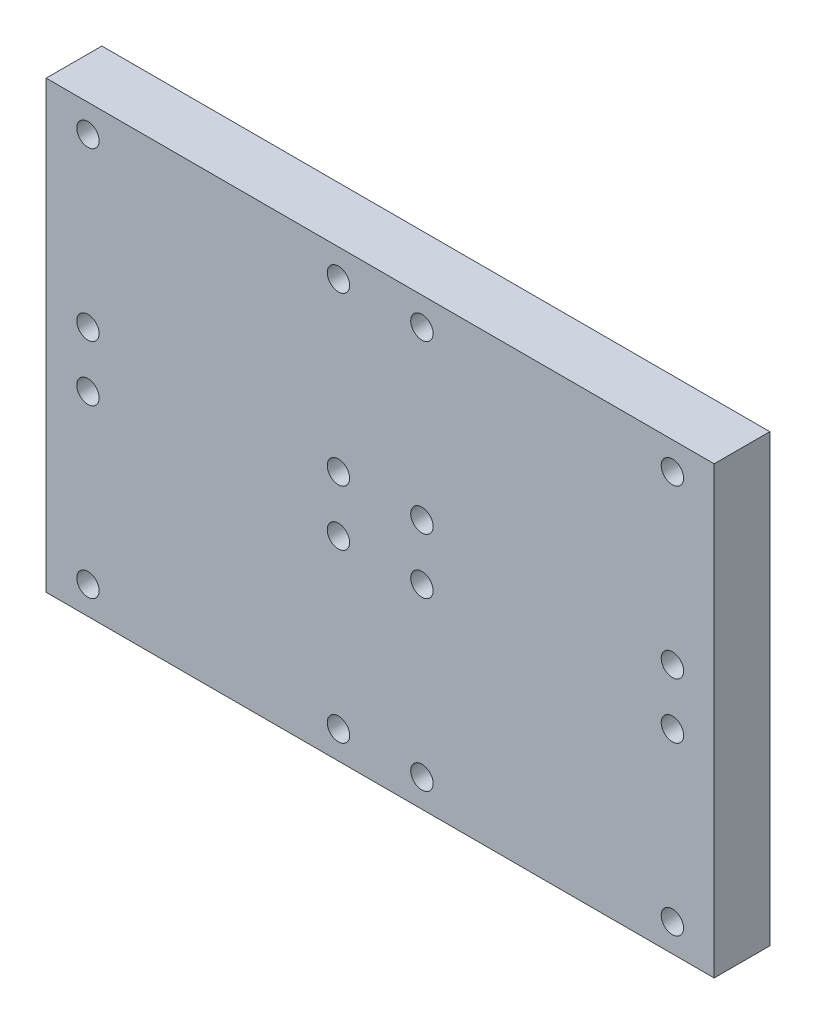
SolidWorks part; units mm, degrees
ref_plane "Front Plane" through (0, 0, 0) normal (0, 0, 1) x (1, 0, 0)
ref_plane "Top Plane" through (0, 0, 0) normal (0, 1, 0) x (1, 0, 0)
ref_plane "Right Plane" through (0, 0, 0) normal (1, 0, 0) x (0, 0, -1)
sketch "Sketch1" plane through (0, 0, 0) normal (0, 0, 1) x (1, 0, 0)
  line L1 (0, 0) -> (152.4, 0)
  line L2 (0, 0) -> (0, 101.6)
  line L3 (0, 101.6) -> (152.4, 101.6)
  line L4 (152.4, 0) -> (152.4, 101.6)
  dimension "D1" = 152.4
  dimension "D2" = 101.6
extrude "Extrude1" add sketch "Sketch1" along normal blind 12.7
hole_wizard "1/4-20 Tapped Hole1" positions "Sketch3" profile "Sketch2" tap size "1/4-20" standard "Example Inch"
sketch "Sketch3" plane through (0, 0, 12.7) normal (0, 0, 1) x (1, 0, 0)
  line L1 (0, 0) -> (152.4, 0) construction
  line L3 (38.1, 0) -> (38.1, 13.9864) construction
  line L6 (0, 101.6) -> (0, 0) construction
  line L9 (0, 25.4) -> (18.2267, 25.4) construction
  point P0 (9.525, 6.35)
  point P1 (66.675, 6.35)
  point P3 (66.675, 44.45)
  point P5 (9.525, 44.45)
  point P33 (0, 50.8)
  point P34 (76.2, 0)
  dimension "D1" = 57.15
  dimension "D2" = 38.1
sketch "Sketch2" plane through (9.525, 6.35, 12.7) normal (1, 0, 0) x (0, -1, 0)
  line L0 (0, 0) -> (0, 12.7)
  line L1 (0, 12.7) -> (2.5527, 12.7)
  line L2 (2.5527, 12.7) -> (2.5527, 0)
  line L5 (2.5527, 0) -> (0, 0)
  line L11 (0, -6.35) -> (0, 107.95) construction
  dimension "Thru Tap Drill Dia." = 5.1054
  dimension "Thru Tap Drill Depth" = 12.7
pattern_linear "LPattern1" count 2 spacing 76.2 along (1, 0, 0) count 2 spacing 50.8 along (0, 1, 0) of "1/4-20 Tapped Hole1"
